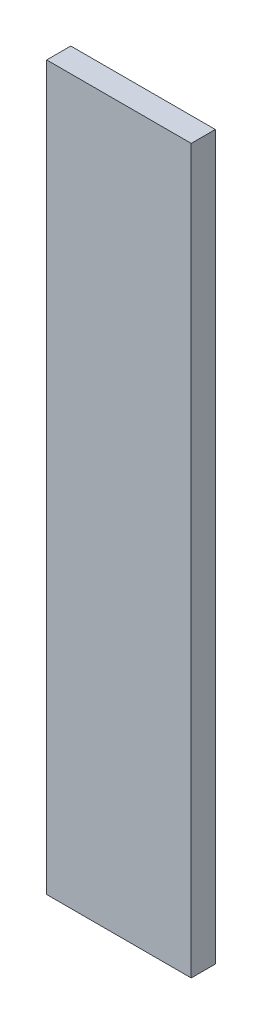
SolidWorks part; units mm, degrees
ref_plane "Ebene vorne" through (0, 0, 0) normal (0, 0, 1) x (1, 0, 0)
ref_plane "Ebene oben" through (0, 0, 0) normal (0, 1, 0) x (1, 0, 0)
ref_plane "Ebene rechts" through (0, 0, 0) normal (1, 0, 0) x (0, 0, -1)
sketch "Skizze1" plane through (0, 0, 0) normal (0, 0, 1) x (1, 0, 0)
  line L1 (0, 0) -> (60, 0)
  line L2 (0, 0) -> (0, 300)
  line L3 (0, 300) -> (60, 300)
  line L4 (60, 0) -> (60, 300)
  dimension "D1" = 60
  dimension "D2" = 300
extrude "Aufsatz-Linear austragen1" add sketch "Skizze1" along normal blind 10
